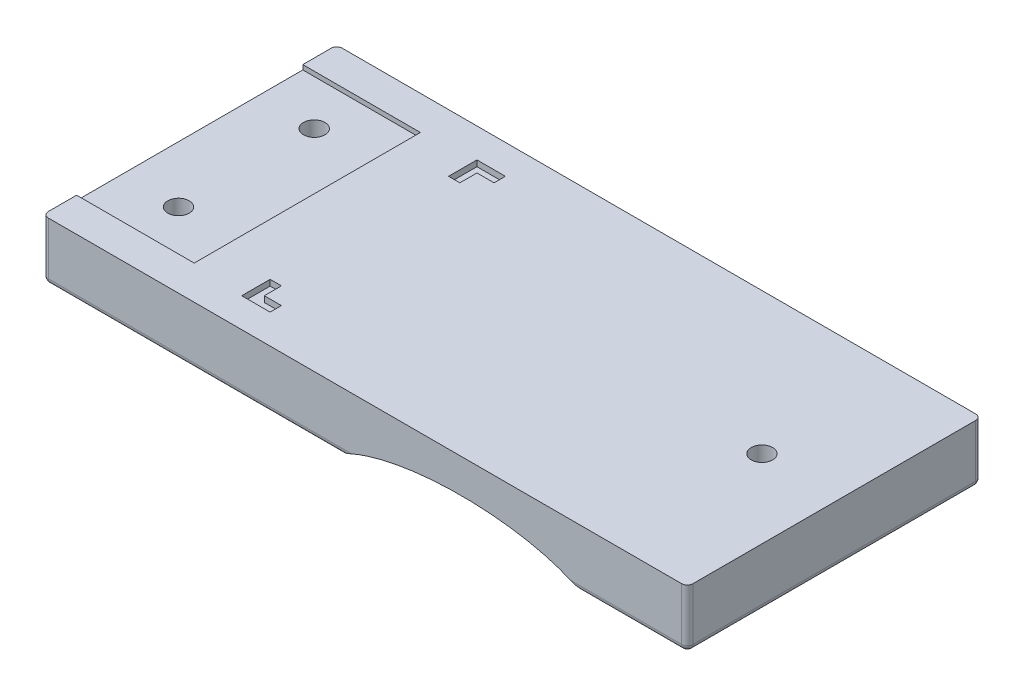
SolidWorks part; units mm, degrees
ref_plane "Front Plane" through (0, 0, 0) normal (0, 0, 1) x (1, 0, 0)
ref_plane "Top Plane" through (0, 0, 0) normal (0, 1, 0) x (1, 0, 0)
ref_plane "Right Plane" through (0, 0, 0) normal (1, 0, 0) x (0, 0, -1)
sketch "Sketch1" plane through (0, 0, 0) normal (0, 1, 0) x (1, 0, 0)
  line L1 (-44.7364, 7.8014) -> (12.2636, 7.8014)
  line L2 (-44.7364, 7.8014) -> (-44.7364, -18.1986)
  line L3 (-44.7364, -18.1986) -> (12.2636, -18.1986)
  line L4 (12.2636, 7.8014) -> (12.2636, -18.1986)
  dimension "D1" = 57
  dimension "D2" = 26
extrude "Boss-Extrude1" add sketch "Sketch1" along normal blind 5.15
sketch "Sketch2" plane through (0, 5.15, 0) normal (0, 1, 0) x (1, 0, 0)
  line L0 (-44.7364, 7.8014) -> (-44.7364, -18.1986) construction
  line L1 (-44.7364, 4.8014) -> (-34.3364, 4.8014)
  line L2 (-44.7364, 4.8014) -> (-44.7364, -15.1986)
  line L3 (-44.7364, -15.1986) -> (-34.3364, -15.1986)
  line L4 (-34.3364, 4.8014) -> (-34.3364, -15.1986)
  line L5 (12.2636, 7.8014) -> (-44.7364, 7.8014) construction
  dimension "D1" = 3
  dimension "D2" = 23
  dimension "D3" = 10.4
extrude "Cut-Extrude1" cut sketch "Sketch2" against normal blind 0.41
sketch "Sketch4" plane through (0, 0, 18.1986) normal (0, 0, 1) x (1, 0, 0)
  line L0 (-20.2364, -2.35) -> (4.7636, -2.35)
  line L1 (-44.7364, 5.15) -> (-44.7364, 0) construction
  ellipse E0 centre (-7.7364, -2.35) end of major axis (-20.2364, -2.35) minor radius 4.5 (4.7636, -2.35) -> (-20.2364, -2.35) ccw
  dimension "D2" = 37
  dimension "D3" = 9
  dimension "D4" = 25
  dimension "D1" = 7.5
extrude "Cut-Extrude3" cut sketch "Sketch4" against normal through all
fillet "Fillet1" radius 0.5 12 edges at (12.2636, 2.575, -7.8014) (-44.7364, 2.575, -7.8014) (-44.7364, 2.575, 18.1986) (12.2636, 2.575, 18.1986) (12.2636, 0, 5.1986) (7.5937, 0, -7.8014) (7.5937, 0, 18.1986) (-31.5665, 0, -7.8014) (-44.7364, 0, 5.1986) (-31.5665, 0, 18.1986) (2.9237, 0, 5.1986) (-18.3965, 0, 5.1986)
hole_wizard "Ø3.0mm Transitional Dowel Hole1" positions "3DSketch2" profile "Sketch9" hole size "Ø3.0" standard "ISO"
sketch3d "3DSketch2"
  line L0 (11.7636, 5.15, -7.8014) -> (-44.2364, 5.15, -7.8014) construction
  line L1 (-44.7364, 4.74, -4.8014) -> (-44.7364, 4.74, 15.1986) construction
  line L2 (-44.7364, 4.74, -4.8014) -> (-44.7364, 4.74, 15.1986) construction
  point P0 (-39.7364, 4.74, -0.8134)
  point P2 (-39.7364, 4.74, 11.1866)
  dimension "D1" = 7
  dimension "D2" = 12
  dimension "D3" = 5
  dimension "D4" = 5
sketch "Sketch9" plane through (-39.7364, 4.74, -0.8134) normal (1, 0, 0) x (0, 0, 1)
  line L0 (0, 0) -> (0, 4.74)
  line L1 (0, 4.74) -> (0.95, 4.74)
  line L2 (0.95, 4.74) -> (0.95, 0)
  line L5 (0.95, 0) -> (0, 0)
  line L11 (0, -6.35) -> (0, 107.95) construction
  dimension "Thru Hole Dia." = 1.9
  dimension "Thru Hole Depth" = 4.74
hole_wizard "Ø3.0mm Transitional Dowel Hole2" positions "3DSketch3" profile "Sketch10" hole size "Ø3.0" standard "ISO"
sketch3d "3DSketch3"
  line L0 (11.7636, 5.15, -7.8014) -> (-44.2364, 5.15, -7.8014) construction
  line L1 (12.2636, 5.15, 17.6986) -> (12.2636, 5.15, -7.3014) construction
  point P0 (5.3636, 5.15, 4.6986)
  dimension "D1" = 12.5
  dimension "D2" = 6.9
sketch "Sketch10" plane through (5.3636, 5.15, 4.6986) normal (1, 0, 0) x (0, 0, 1)
  line L0 (0, 0) -> (0, 5.15)
  line L1 (0, 5.15) -> (0.95, 5.15)
  line L2 (0.95, 5.15) -> (0.95, 0)
  line L5 (0.95, 0) -> (0, 0)
  line L11 (0, -6.35) -> (0, 107.95) construction
  dimension "Thru Hole Dia." = 1.9
  dimension "Thru Hole Depth" = 5.15
sketch "Sketch11" plane through (0, 5.15, 0) normal (0, 1, 0) x (1, 0, 0)
  line L0 (13.5491, -5.1986) -> (-49.9621, -5.1986) construction
  line L2 (11.7636, 7.8014) -> (-44.2364, 7.8014) construction
  line L3 (-29.7364, 5.2014) -> (-27.2264, 5.2014)
  line L4 (-29.7364, 5.2014) -> (-29.7364, 2.6914)
  line L5 (-29.7364, 2.6914) -> (-28.7364, 2.6914)
  line L6 (-28.7364, 2.6914) -> (-28.7364, 4.2014)
  line L7 (-44.7364, 4.8014) -> (-44.7364, -15.1986) construction
  line L8 (-44.2364, -18.1986) -> (11.7636, -18.1986) construction
  line L9 (-28.7364, 4.2014) -> (-27.2264, 4.2014)
  line L10 (-27.2264, 4.2014) -> (-27.2264, 5.2014)
  line L12 (-29.7364, -15.5986) -> (-29.7364, -13.0886)
  line L13 (-29.7364, -13.0886) -> (-28.7364, -13.0886)
  line L14 (-28.7364, -13.0886) -> (-28.7364, -14.5986)
  line L15 (-27.2264, -14.5986) -> (-27.2264, -15.5986)
  line L16 (-28.7364, -14.5986) -> (-27.2264, -14.5986)
  line L17 (-29.7364, -15.5986) -> (-27.2264, -15.5986)
  dimension "D1" = 2.51
  dimension "D2" = 2.6
  dimension "D3" = 15
  dimension "D4" = 1
  dimension "D5" = 2.6
extrude "Cut-Extrude4" cut sketch "Sketch11" against normal blind 0.52
